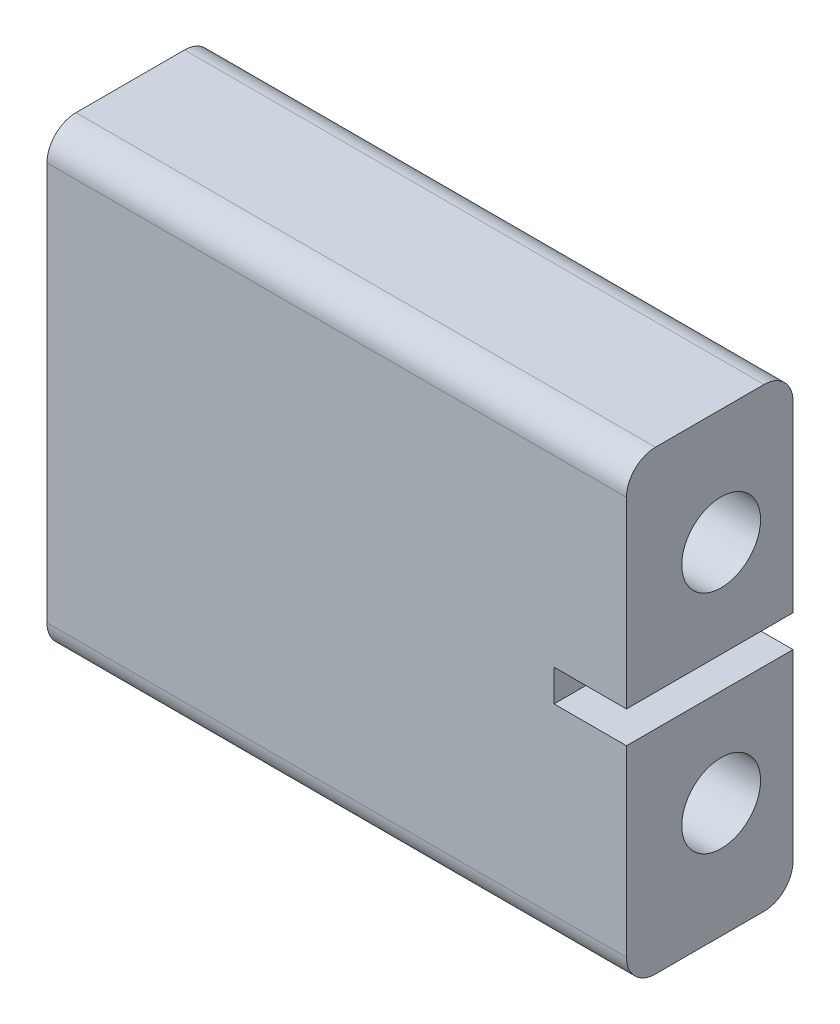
SolidWorks part; units mm, degrees
ref_plane "Front Plane" through (0, 0, 0) normal (0, 0, 1) x (1, 0, 0)
ref_plane "Top Plane" through (0, 0, 0) normal (0, 1, 0) x (1, 0, 0)
ref_plane "Right Plane" through (0, 0, 0) normal (1, 0, 0) x (0, 0, -1)
sketch "Sketch1" plane through (0, 0, 0) normal (1, 0, 0) x (0, 0, -1)
  line L6 (26.744, 1.639) -> (19.444, 1.639)
  line L8 (23.594, 16.589) -> (23.594, 6.689) construction
  line L9 (19.444, 21.639) -> (26.744, 21.639)
  line L12 (26.744, 21.639) -> (26.744, 1.639)
  line L13 (19.444, 21.639) -> (19.444, 1.639)
  circle A0 centre (23.594, 16.589) radius 1.7272
  circle A1 centre (23.594, 6.689) radius 1.7272
  point P9 (23.594, 16.589)
  point P15 (23.594, 11.639)
  point P23 (26.744, 11.639)
  dimension "D1" = 3.4544
  dimension "D2" = 4.15
  dimension "D3" = 3.15
  dimension "D4" = 9.9
  dimension "D5" = 20
extrude "Boss-Extrude1" add sketch "Sketch1" along normal blind 25.4
sketch "Sketch2" plane through (25.4, 0, 0) normal (1, 0, 0) x (0, 0, -1)
  line L0 (19.444, 12.3375) -> (26.744, 12.3375)
  line L1 (19.444, 21.639) -> (19.444, 1.639) construction
  line L2 (26.744, 1.639) -> (26.744, 21.639) construction
  line L3 (26.744, 12.3375) -> (26.744, 10.9405)
  line L4 (26.744, 10.9405) -> (19.444, 10.9405)
  line L5 (19.444, 10.9405) -> (19.444, 12.3375)
  point P6 (26.744, 11.639)
  dimension "D1" = 1.397
extrude "Cut-Extrude1" cut sketch "Sketch2" against normal blind 3.175
fillet "Fillet1" radius 1.27 4 edges at (12.7, 1.639, -26.744) (12.7, 1.639, -19.444) (12.7, 21.639, -26.744) (12.7, 21.639, -19.444)
